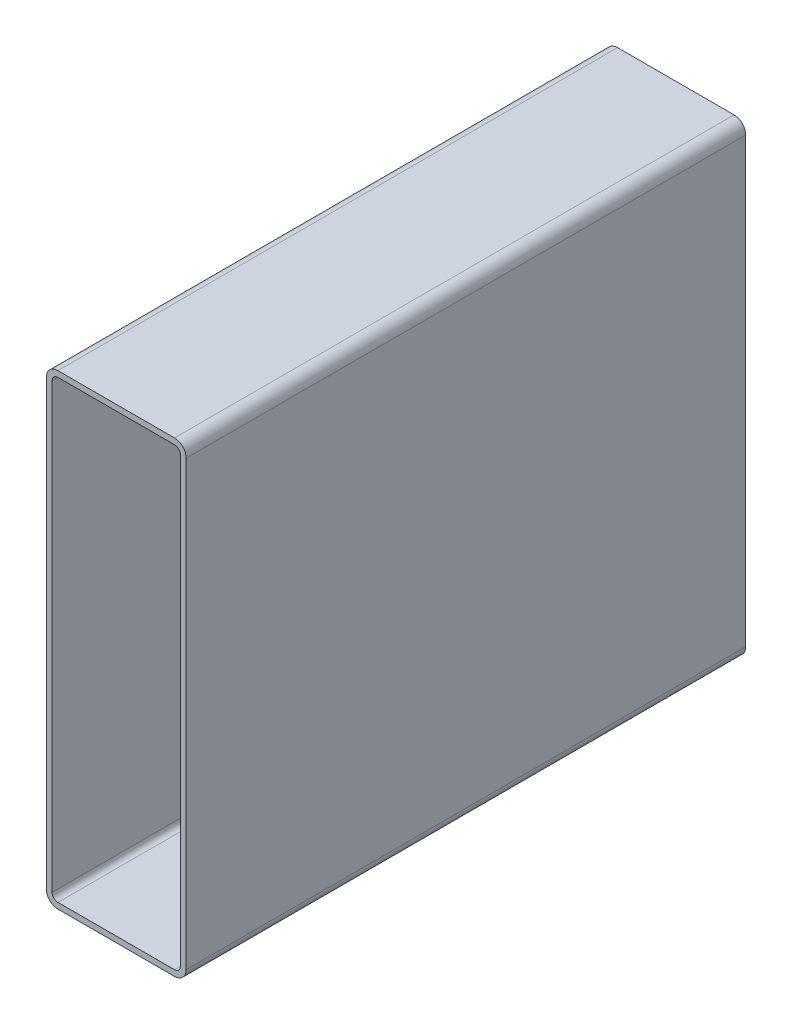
SolidWorks part; units mm, degrees
ref_plane "Front Plane" through (0, 0, 0) normal (0, 0, 1) x (1, 0, 0)
ref_plane "Top Plane" through (0, 0, 0) normal (0, 1, 0) x (1, 0, 0)
ref_plane "Right Plane" through (0, 0, 0) normal (1, 0, 0) x (0, 0, -1)
sketch "Sketch1" plane through (0, 0, 0) normal (0, 0, 1) x (1, 0, 0)
sketch_block_instance "HSS10x3x0.125-1"
sketch_block "HSS10x3x0.125"
extrude "Boss-Extrude1" add sketch "Sketch1" along normal blind 304.8
